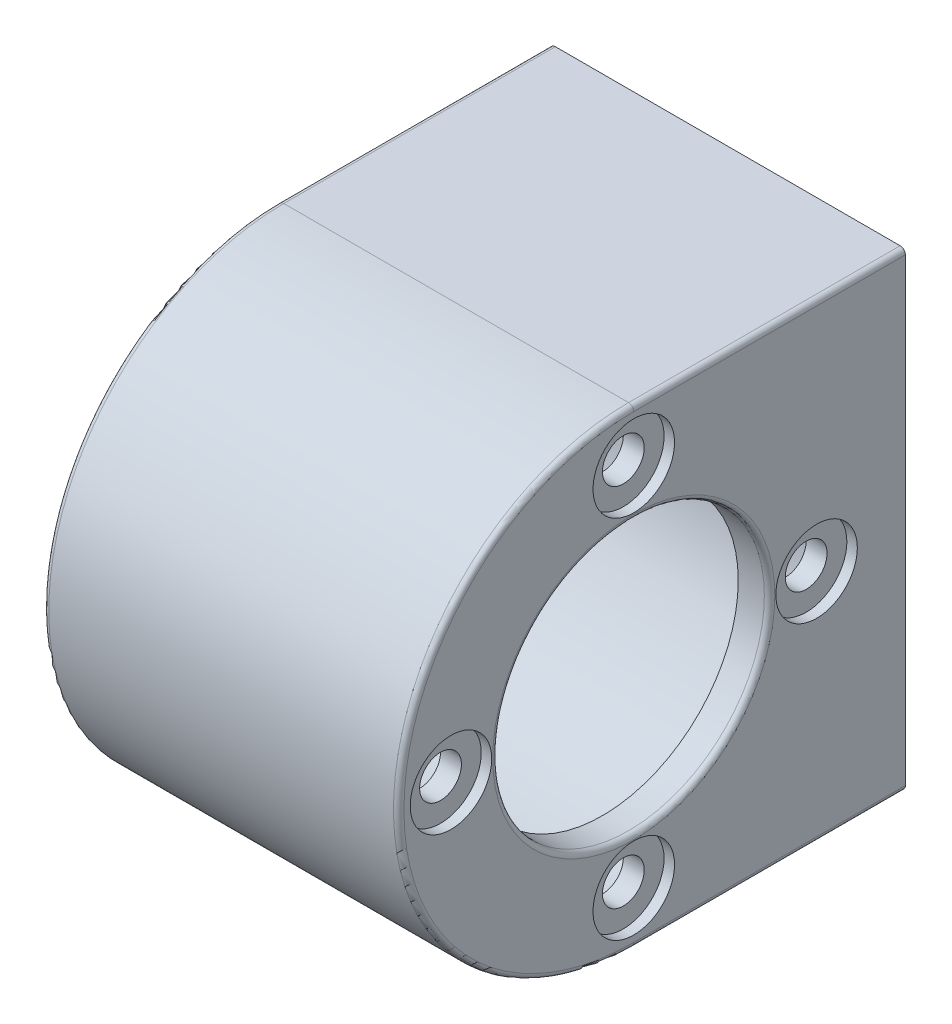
SolidWorks part; units mm, degrees
ref_plane "前视基准面" through (0, 0, 0) normal (0, 0, 1) x (1, 0, 0)
ref_plane "上视基准面" through (0, 0, 0) normal (0, 1, 0) x (1, 0, 0)
ref_plane "右视基准面" through (0, 0, 0) normal (1, 0, 0) x (0, 0, -1)
sketch "草图1" plane through (0, 0, 0) normal (0, 0, 1) x (1, 0, 0)
  line L0 (-29.9163, 25) -> (-22.9163, 25)
  line L1 (-22.9163, 25) -> (37.0837, 25)
  line L3 (-22.9163, -25) -> (37.0837, -25)
  line L4 (37.0837, 25) -> (37.0837, -25)
  line L5 (-28.6213, 19.2951) -> (37.0837, -25) construction
  line L6 (-28.6213, -19.2951) -> (37.0837, 25) construction
  line L7 (-44.0083, 0) -> (45.9917, 0) construction
  line L9 (-29.9163, 25) -> (-29.9163, -25)
  line L10 (-29.9163, -25) -> (-22.9163, -25)
  point P0 (0, 0)
  point P11 (-29.9163, 0)
  dimension "D3" = 50
extrude "凸台-拉伸1" add sketch "草图1" along normal blind 4
sketch "草图2" plane through (0, 0, 4) normal (0, 0, 1) x (1, 0, 0)
  line L0 (44.2177, 0) -> (-45.7823, 0) construction
  line L1 (-29.9163, 25) -> (-29.9163, -25) construction
  line L5 (-10.4163, 15) -> (4.5837, -15) construction
  line L6 (-10.4163, -15) -> (4.5837, 15) construction
  circle A0 centre (-10.4163, -15) radius 1.5
  circle A1 centre (4.5837, -15) radius 1.5
  circle A2 centre (4.5837, 15) radius 1.5
  circle A3 centre (-10.4163, 15) radius 1.5
  point P0 (-2.9163, 0)
  dimension "D1" = 27
sketch "草图4" plane through (37.0837, 0, 0) normal (1, 0, 0) x (0, 0, -1)
  line L0 (-4, -25) -> (-4, 25) construction
  line L1 (0, 25) -> (-26, 25)
  line L2 (0, 25) -> (0, -25)
  line L3 (0, -25) -> (-26, -25)
  arc A0 (-26, 25) -> (-26, -25) centre (-26, 0) ccw
  dimension "D2" = 22
  dimension "D1" = 50
extrude "凸台-拉伸2" add sketch "草图4" against normal blind 8
sketch "草图5" plane through (37.0837, 0, 0) normal (1, 0, 0) x (0, 0, -1)
  circle A0 centre (-26, 0) radius 21
  dimension "D1" = 42
extrude "切除-拉伸2" cut sketch "草图5" against normal blind 7
sketch "草图6" plane through (30.0837, 0, 0) normal (1, 0, 0) x (0, 0, -1)
  circle A0 centre (-26, 0) radius 18
  dimension "D1" = 36
extrude "切除-拉伸3" cut sketch "草图6" against normal blind 1
ref_plane "基准面1" through (14.0837, 0, 0) normal (1, 0, 0) x (0, 0, -1)
sketch "草图7" plane through (14.0837, 0, 0) normal (1, 0, 0) x (0, 0, -1)
  line L0 (0, -25) -> (0, 25) construction
  line L1 (-26, 21) -> (-4, 21)
  line L3 (-26, -21) -> (-4, -21)
  line L4 (-4, 21) -> (-4, -21)
  arc A0 (-26, 21) -> (-26, -21) centre (-26, 0) ccw
  circle A1 centre (-26, 0) radius 13
  dimension "D1" = 26
  dimension "D2" = 21
  dimension "D3" = 42
  dimension "D4" = 4
  dimension "D5" = 22
extrude "凸台-拉伸3" add sketch "草图7" against normal blind 3
sketch "草图8" plane through (14.0837, 0, 0) normal (1, 0, 0) x (0, 0, -1)
  circle A1 centre (-26, 17.4883) radius 2
  circle A2 centre (-43.5, -0.0117) radius 2
  circle A3 centre (-26, -17.5117) radius 2
  circle A4 centre (-8.5, -0.0117) radius 2
  dimension "D1" = 4
  dimension "D2" = 4
  dimension "D3" = 35
  dimension "D4" = 35
extrude "切除-拉伸4" cut sketch "草图8" against normal blind 4
sketch "草图10" plane through (0, 0, 4) normal (0, 0, 1) x (1, 0, 0)
  line L1 (14.0837, 7.5) -> (29.0837, 7.5)
  line L2 (14.0837, 7.5) -> (14.0837, -7.5)
  line L3 (14.0837, -7.5) -> (29.0837, -7.5)
  line L4 (29.0837, 7.5) -> (29.0837, -7.5)
  line L5 (14.0837, 7.5) -> (29.0837, -7.5) construction
  line L6 (14.0837, -7.5) -> (29.0837, 7.5) construction
  point P0 (21.5837, 0)
  dimension "D1" = 15
extrude "切除-拉伸5" cut sketch "草图10" against normal blind 4
fillet "圆角1" radius 3 4 edges at (14.0837, 7.5, 2) (14.0837, -7.5, 2) (29.0837, -7.5, 2) (29.0837, 7.5, 2)
hole_wizard "M4 螺纹孔2" positions "3D草图1" profile "草图11" tap size "M4" standard "GB"
sketch3d "3D草图1"
  point P6 (-10.4163, -15, 4)
  point P9 (4.5837, -15, 4)
  point P12 (4.5837, 15, 4)
  point P15 (-10.4163, 15, 4)
sketch "草图11" plane through (-10.4163, -15, 4) normal (1, 0, 0) x (0, -1, 0)
  line L0 (0, 0) -> (0, 12.4914)
  line L1 (0, 12.4914) -> (1.65, 11.5)
  line L2 (1.65, 11.5) -> (1.65, 0.375)
  line L3 (1.65, 0.375) -> (2.025, 0)
  line L5 (2.025, 0) -> (0, 0)
  line L6 (-1.65, 0.375) -> (-2.025, 0) construction
  line L10 (0, 12.4914) -> (-1.65, 11.5) construction
  line L11 (0, -6.35) -> (0, 107.95) construction
  dimension "螺纹孔钻头直径" = 3.3
  dimension "螺纹孔钻头深度" = 11.5
  dimension "近端锥形沉头孔直径" = 4.05
  dimension "近端锥形沉头孔角度" = 90
  dimension "导头角度" = 118
sketch "草图12" plane through (37.0837, 0, 0) normal (1, 0, 0) x (0, 0, -1)
  line L1 (26.3377, -41.2438) -> (-87.7577, -41.2438)
  line L2 (26.3377, -41.2438) -> (26.3377, 56.5853)
  line L3 (26.3377, 56.5853) -> (-87.7577, 56.5853)
  line L4 (-87.7577, -41.2438) -> (-87.7577, 56.5853)
extrude "切除-拉伸6" cut sketch "草图12" against normal blind 23
ref_plane "基准面2" through (-15.9163, 0, 0) normal (1, 0, 0) x (0, 0, -1)
chamfer "倒角1" distance 4 angle 45 2 edges at (14.0837, -25, 2) (14.0837, 25, 2)
sketch "草图17" plane through (0, 0, 4) normal (0, 0, 1) x (1, 0, 0)
  line L1 (14.0837, 21) -> (-46.9468, 21)
  line L2 (14.0837, 21) -> (14.0837, 29.1262)
  line L3 (14.0837, 29.1262) -> (-46.9468, 29.1262)
  line L4 (-46.9468, 21) -> (-46.9468, 29.1262)
  line L5 (14.0837, -21) -> (-41.6645, -21)
  line L6 (14.0837, -21) -> (14.0837, -29.4196)
  line L7 (14.0837, -29.4196) -> (-41.6645, -29.4196)
  line L8 (-41.6645, -21) -> (-41.6645, -29.4196)
extrude "切除-拉伸9" cut sketch "草图17" against normal blind 10
sketch "草图18" plane through (14.0837, 0, 0) normal (1, 0, 0) x (0, 0, -1)
  line L0 (-26, 22.5) -> (0, 22.5)
  line L1 (0, 22.5) -> (0, 21)
  line L2 (0, 21) -> (-17.9223, 21)
  line L3 (-17.9223, -21) -> (0, -21)
  line L4 (0, -21) -> (0, -22.5)
  line L5 (0, -22.5) -> (-26, -22.5)
  line L6 (-4, -4.717) -> (-4, 4.717)
  circle A0 centre (-26, 0) radius 21
  arc A1 (-26, 22.5) -> (-26, -22.5) centre (-26, 0) ccw
  arc A2 (-17.9223, -21) -> (-4, -4.717) centre (-26, 0) ccw
  arc A3 (-4, 4.717) -> (-17.9223, 21) centre (-26, 0) ccw
  dimension "D1" = 22.5
extrude "凸台-拉伸4" add sketch "草图18" against normal blind 34
sketch "草图19" plane through (-29.9163, 0, 0) normal (-1, 0, 0) x (0, 0, 1)
  line L1 (0, -21) -> (4, -21)
  line L2 (0, -21) -> (0, 21)
  line L3 (0, 21) -> (4, 21)
  line L4 (4, -21) -> (4, 21)
extrude "切除-拉伸10" cut sketch "草图19" against normal blind 10
fillet "圆角2" radius 2.5 2 edges at (-4.4163, -21, 4) (-4.4163, 21, 4)
fillet "圆角3" radius 1.5 4 edges at (-4.4163, -4.717, 4) (-4.4163, -21, 17.9223) (-4.4163, 21, 17.9223) (-4.4163, 4.717, 4)
sketch "草图20" plane through (14.0837, 0, 0) normal (1, 0, 0) x (0, 0, -1)
  circle A0 centre (-8.5, -0.0117) radius 3.9
  circle A1 centre (-26, -17.5117) radius 3.9
  circle A2 centre (-43.5, -0.0117) radius 3.9
  circle A3 centre (-26, 17.4883) radius 3.9
  point P12 (-26, -0.0117)
  dimension "D2" = 7.8
  dimension "D1" = 4
extrude "切除-拉伸11" cut sketch "草图20" against normal blind 1
chamfer "倒角3" distance 0.5 angle 45 13 edges at (-19.9163, -21, 9.2545) (-19.9163, -20.2678, 4.7322) (-19.9163, -19.9593, 13.4369) (-19.9163, -15.49, 4) (-19.9163, -15.298, 9.5008) (-19.9163, -11.0357, 5.095) (-19.9163, 20.2678, 4.7322) (-19.9163, 15.49, 4) (-19.9163, 21, 9.2545) (-19.9163, 11.0357, 5.095) (-19.9163, 19.9593, 13.4369) (-19.9163, 15.298, 9.5008) (-19.9163, 0, 5)
sketch "草图21" plane through (14.0837, 0, 0) normal (1, 0, 0) x (0, 0, -1)
  line L0 (-48.5, 0) -> (-48.5, 22.5)
  line L1 (-48.5, 22.5) -> (-26, 22.5)
  arc A0 (-26, 22.5) -> (-26, -22.5) centre (-26, 0) ccw construction
  arc A1 (-26, 22.5) -> (-48.5, 0) centre (-26, 0) ccw
extrude "凸台-拉伸5" add sketch "草图21" against normal blind 34
sketch "草图22" plane through (0, 0, 48.5) normal (0, 0, 1) x (1, 0, 0)
  line L0 (-19.9163, 22.5) -> (14.0837, 22.5) construction
  line L1 (-19.9163, 22.5) -> (-19.9163, 0) construction
  line L2 (14.0837, 22.5) -> (14.0837, 0) construction
  circle A0 centre (11.0837, 19.5) radius 1.25
  circle A1 centre (-16.9163, 19.5) radius 1.25
  dimension "D1" = 2.5
  dimension "D2" = 2.5
  dimension "D3" = 3
  dimension "D4" = 3
  dimension "D5" = 3
  dimension "D6" = 3
extrude "切除-拉伸12" cut sketch "草图22" against normal blind 10
sketch "草图23" plane through (-19.9163, 0, 0) normal (-1, 0, 0) x (0, 0, 1)
  line L0 (48.5, 16.5) -> (41.2971, 16.5)
  line L1 (48.5, 22.5) -> (48.5, 0) construction
  line L2 (0, 22.5) -> (48.5, 22.5) construction
  line L3 (48.5, 16.5) -> (48.5, 0)
  arc A0 (48.5, 0) -> (41.2971, 16.5) centre (26, 0) ccw
  dimension "D1" = 6
extrude "切除-拉伸13" cut sketch "草图23" against normal through all
fillet "圆角4" radius 1.5 1 edges at (-2.9163, 16.5, 41.2971)
sketch "草图24" plane through (0, 22.5, 0) normal (0, 1, 0) x (1, 0, 0)
  line L0 (-7.9163, -48.5) -> (2.0837, -48.5) construction
  line L1 (-19.9163, -48.5) -> (14.0837, -48.5) construction
  line L2 (-7.9163, -43.5) -> (2.0837, -43.5)
  line L3 (-7.9163, -53.5) -> (2.0837, -53.5)
  arc A0 (-7.9163, -43.5) -> (-7.9163, -53.5) centre (-7.9163, -48.5) ccw
  arc A1 (2.0837, -53.5) -> (2.0837, -43.5) centre (2.0837, -48.5) ccw
  point P4 (-2.9163, -48.5)
  dimension "D2" = 5
  dimension "D1" = 10
extrude "切除-拉伸14" cut sketch "草图24" against normal blind 7
chamfer "倒角4" distance 1 angle 45 3 edges at (5.6192, 22.5, 44.9645) (-11.4519, 22.5, 44.9645) (-2.9163, 22.5, 43.5)
fillet "圆角5" radius 0.5 11 edges at (14.0837, 16.5, 46.6175) (-19.9163, 16.5, 46.6175) (-19.9163, 15.6495, 43.3829) (14.0837, 15.6495, 43.3829) (14.0837, -9.7428, 46.2812) (-19.9163, -9.7428, 46.2812) (14.0837, -22.5, 13) (-19.9163, -22.5, 13) (14.0837, 22.5, 24.25) (-19.9163, 22.5, 24.25) (14.0837, 0, 13)
sketch "草图25" plane through (0, 22.5, 0) normal (0, 1, 0) x (1, 0, 0)
  line L0 (-19.4163, 0) -> (13.5837, 0) construction
  line L1 (-12.9163, -19) -> (7.0837, -19)
  line L2 (-15.4163, -16.5) -> (-15.4163, -7.5)
  line L3 (-12.9163, -5) -> (7.0837, -5)
  line L4 (9.5837, -16.5) -> (9.5837, -7.5)
  line L5 (-15.4163, -19) -> (9.5837, -5) construction
  line L6 (-15.4163, -5) -> (9.5837, -19) construction
  line L7 (-2.9163, -21.25) -> (25.2211, -21.25) construction
  line L13 (-2.9163, 0) -> (-2.9163, -42.5) construction
  line L14 (-7.9163, -42.5) -> (2.0837, -42.5) construction
  arc A0 (7.0837, -19) -> (9.5837, -16.5) centre (7.0837, -16.5) ccw
  arc A1 (-12.9163, -19) -> (-15.4163, -16.5) centre (-12.9163, -16.5) cw
  arc A2 (7.0837, -5) -> (9.5837, -7.5) centre (7.0837, -7.5) cw
  arc A3 (-15.4163, -7.5) -> (-12.9163, -5) centre (-12.9163, -7.5) cw
  point P0 (-2.9163, -12)
  dimension "D3" = 2.5
  dimension "D1" = 14
  dimension "D2" = 25
  dimension "D4" = 12
extrude "切除-拉伸15" cut sketch "草图25" against normal blind 1
ref_plane "基准面3" through (0, 32.5, 0) normal (0, 1, 0) x (1, 0, 0)
sketch "草图27" plane through (0, 0, 48.5) normal (0, 0, 1) x (1, 0, 0)
  line L5 (7.0837, 16.5) -> (13.5837, 16.5)
  line L6 (14.0837, 17) -> (14.0837, 22)
  line L7 (13.5837, 22.5) -> (8.0837, 22.5)
  line L8 (8.0837, 22.5) -> (7.0837, 21.5)
  line L9 (7.0837, 21.5) -> (7.0837, 16.5)
  line L10 (7.0837, 16.5) -> (13.5837, 16.5)
  line L11 (14.0837, 17) -> (14.0837, 22)
  line L12 (13.5837, 22.5) -> (8.0837, 22.5)
  line L13 (8.0837, 22.5) -> (7.0837, 21.5)
  line L14 (7.0837, 21.5) -> (7.0837, 16.5)
  line L15 (-19.9163, 22) -> (-19.9163, 17)
  line L16 (-19.4163, 16.5) -> (-12.9163, 16.5)
  line L17 (-12.9163, 16.5) -> (-12.9163, 21.5)
  line L18 (-12.9163, 21.5) -> (-13.9163, 22.5)
  line L19 (-13.9163, 22.5) -> (-19.4163, 22.5)
  line L20 (-19.9163, 22) -> (-19.9163, 17)
  line L21 (-19.4163, 16.5) -> (-12.9163, 16.5)
  line L22 (-12.9163, 16.5) -> (-12.9163, 21.5)
  line L23 (-12.9163, 21.5) -> (-13.9163, 22.5)
  line L24 (-13.9163, 22.5) -> (-19.4163, 22.5)
  circle A0 centre (11.0837, 19.5) radius 1.25 construction
  circle A1 centre (11.0837, 19.5) radius 1.25
  arc A2 (13.5837, 16.5) -> (14.0837, 17) centre (13.5837, 17) ccw
  arc A3 (14.0837, 22) -> (13.5837, 22.5) centre (13.5837, 22) ccw
  arc A4 (13.5837, 16.5) -> (14.0837, 17) centre (13.5837, 17) ccw
  arc A5 (14.0837, 22) -> (13.5837, 22.5) centre (13.5837, 22) ccw
  circle A6 centre (-16.9163, 19.5) radius 1.25 construction
  circle A7 centre (-16.9163, 19.5) radius 1.25
  arc A8 (-19.9163, 17) -> (-19.4163, 16.5) centre (-19.4163, 17) ccw
  arc A9 (-19.4163, 22.5) -> (-19.9163, 22) centre (-19.4163, 22) ccw
  arc A10 (-19.9163, 17) -> (-19.4163, 16.5) centre (-19.4163, 17) ccw
  arc A11 (-19.4163, 22.5) -> (-19.9163, 22) centre (-19.4163, 22) ccw
  dimension "D1" = 0
  dimension "D2" = 0
extrude "凸台-拉伸6" add sketch "草图27" along normal blind 6
mirror "镜向2" about plane through (0, 32.5, 0) normal (0, 1, 0)
sketch "草图26" plane through (0, 42.5, 0) normal (0, -1, 0) x (1, 0, 0)
  line L1 (72.6244, -61.618) -> (-51.9439, -61.618)
  line L2 (72.6244, -61.618) -> (72.6244, 82.4001)
  line L3 (72.6244, 82.4001) -> (-51.9439, 82.4001)
  line L4 (-51.9439, -61.618) -> (-51.9439, 82.4001)
extrude "切除-拉伸16" cut sketch "草图26" along normal blind 100
sketch "草图35" plane through (14.0837, 0, 0) normal (1, 0, 0) x (0, 0, -1)
  line L0 (-26, 42.5) -> (-74.415, 42.5)
  line L1 (-74.415, 42.5) -> (-74.415, 54.8845)
  line L2 (-74.415, 54.8845) -> (-46.0979, 54.8845)
  arc A0 (-46.0979, 54.8845) -> (-26, 42.5) centre (-26, 65) ccw
extrude "切除-拉伸17" cut sketch "草图35" against normal blind 42
fillet "圆角6" radius 0.5 8 edges at (-19.9163, 50.6439, 42.8415) (14.0837, 50.6439, 42.8415) (14.0837, 45.5299, 37.2767) (-19.9163, 45.5299, 37.2767) (14.047, 42.8121, 29.7346) (-19.86, 50.2398, 42.9819) (-19.8797, 42.8121, 29.7346) (14.0146, 50.2719, 43.0098)
ref_plane "基准面4" through (-2.9163, 0, 0) normal (-1, 0, 0) x (0, 0, 1)
sketch "草图36" plane through (-2.9163, 0, 0) normal (-1, 0, 0) x (0, 0, 1)
  line L0 (26, 87.5) -> (26, 86)
  line L1 (26, 44) -> (26, 42.5)
  circle A0 centre (26, 65) radius 21 construction
  arc A1 (43.5641, 50.9375) -> (26, 87.5) centre (26, 65) ccw construction
  arc A2 (26, 44) -> (26, 86) centre (26, 65) ccw
  arc A3 (43.5641, 50.9375) -> (26, 87.5) centre (26, 65) ccw
  arc A4 (26, 42.5) -> (43.5641, 50.9375) centre (26, 65) ccw construction
  arc A5 (26, 42.5) -> (43.5641, 50.9375) centre (26, 65) ccw
extrude "凸台-拉伸7" add sketch "草图36" along normal mid plane 32
